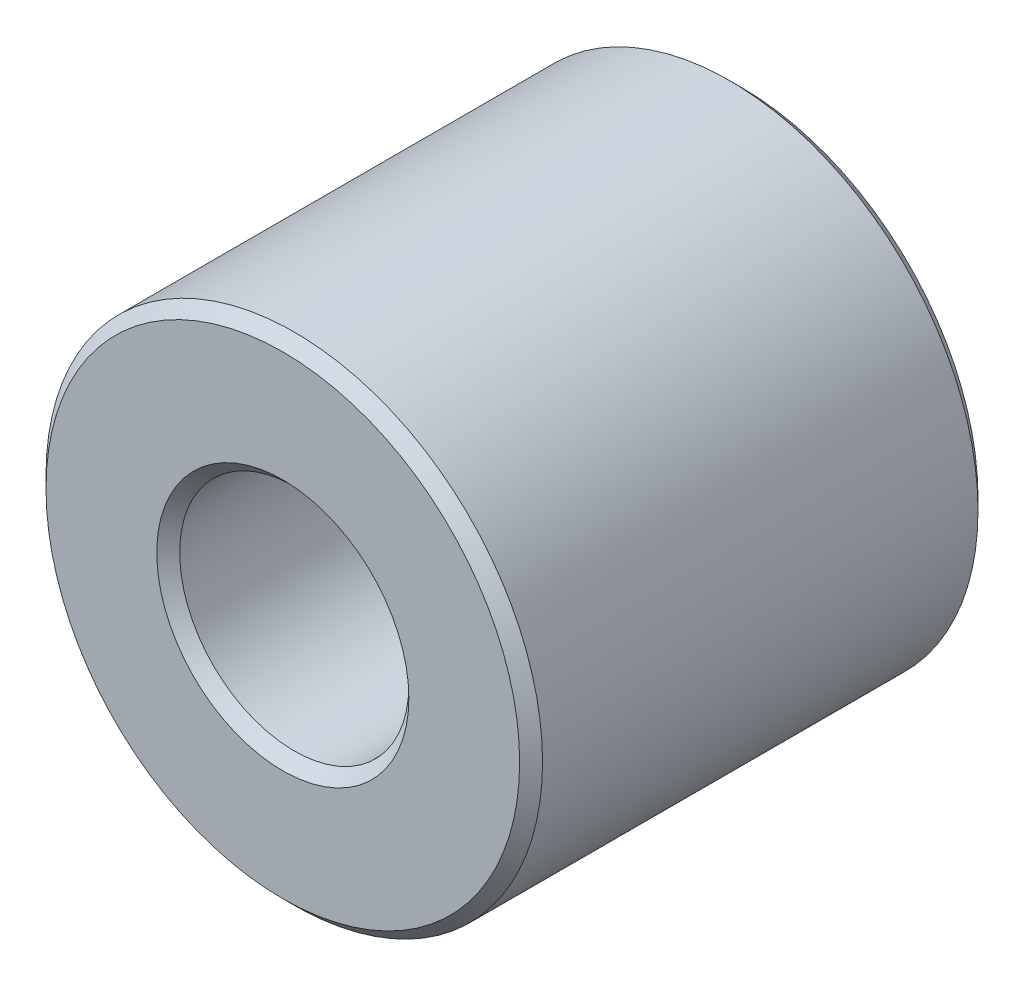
SolidWorks part; units mm, degrees
ref_plane "Front Plane" through (0, 0, 0) normal (0, 0, 1) x (1, 0, 0)
ref_plane "Top Plane" through (0, 0, 0) normal (0, 1, 0) x (1, 0, 0)
ref_plane "Right Plane" through (0, 0, 0) normal (1, 0, 0) x (0, 0, -1)
sketch "Sketch1" plane through (0, 0, 0) normal (0, 0, 1) x (1, 0, 0)
  circle A0 centre (0, 0) radius 6
  circle A1 centre (0, 0) radius 13
  dimension "D1" = 12
  dimension "D2" = 26
extrude "Boss-Extrude1" add sketch "Sketch1" along normal mid plane 24
chamfer "Chamfer1" distance 0.6 angle 45 4 edges at (6, 0, -12) (13, 0, -12) (6, 0, 12) (13, 0, 12)
